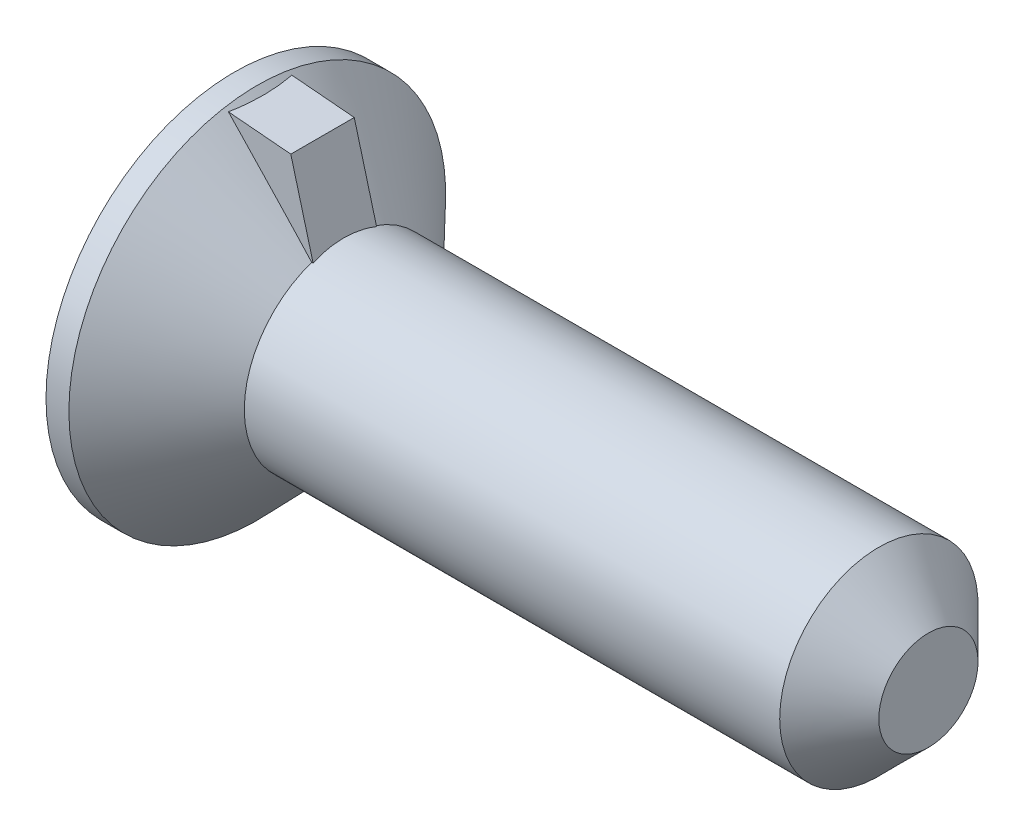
SolidWorks part; units mm, degrees
ref_plane "Front Plane" through (0, 0, 0) normal (0, 0, 1) x (1, 0, 0)
ref_plane "Top Plane" through (0, 0, 0) normal (0, 1, 0) x (1, 0, 0)
ref_plane "Right Plane" through (0, 0, 0) normal (1, 0, 0) x (0, 0, -1)
other "Configuration Table"
sketch "BodySke" plane through (0, 0, 0) normal (0, 0, 1) x (1, 0, 0)
  line L0 (0, 0) -> (44.1549, 0) construction
  line L1 (0, 0) -> (0, 9.5)
  line L2 (0, 9.5) -> (1.1544, 9.5)
  line L3 (1.1544, 9.5) -> (5.5, 5)
  line L4 (5.5, 5) -> (32.5, 5)
  line L5 (32.5, 5) -> (35, 2.5)
  line L6 (35, 2.5) -> (35, 0)
  line L7 (35, 0) -> (0, 0)
  line L8 (0, -9.5) -> (1.1544, -9.5) construction
  line L9 (1.1544, -9.5) -> (5.5, -5) construction
  line L10 (5.5, 5) -> (5.5, 0) construction
  line L11 (33.5, 0) -> (33.5, 5) construction
  line L12 (5.5, 5) -> (5.5, 13.4) construction
  line L13 (1.4441, 9.2) -> (4.445, 8.9375) construction
  line L14 (4.445, 8.9375) -> (5.5, 5) construction
  line L15 (1.4441, 9.2) -> (5.5, 9.2) construction
  point P19 (0, 4.172)
revolve "BaseBody" add sketch "BodySke" angle 360 about L0
sketch "NibSke" plane through (0, 0, 0) normal (0, 0, 1) x (1, 0, 0)
  line L0 (4.445, 8.9375) -> (6.8397, 0)
  line L1 (35, 0) -> (0, 0) construction
  line L2 (6.8397, 0) -> (1.1544, 0)
  line L5 (1.1544, 9.2253) -> (4.445, 8.9375)
  line L6 (4.445, 8.9375) -> (5.5, 5) construction
  line L7 (1.4441, 9.2) -> (4.445, 8.9375) construction
  line L8 (1.1544, 9.2253) -> (1.1544, 0)
  line L9 (1.1544, 9.5) -> (1.1544, -9.5) construction
extrude "Nib" add sketch "NibSke" along normal mid plane 3.2
sketch "ThdSchSke" plane through (0, 0, 0) normal (0, 0, 1) x (1, 0, 0)
  line L0 (0, 0) -> (35.8559, 0) construction
  line L1 (0, 9.5) -> (0, -9.5) construction
  line L2 (31, 5.9561) -> (31, 5)
  line L3 (31, 5.9561) -> (31.9561, 5.9561)
  line L4 (31.9561, 5.9561) -> (31.9561, 5)
  line L5 (31.9561, 5) -> (31.478, 4.172)
  line L6 (31.478, 4.172) -> (31, 5)
revolve "ThreadSchematic" [suppressed] cut sketch "ThdSchSke" angle 360 about L0
pattern_linear "ThdSchPat" [suppressed]
equation "\"Thread_minor@ThreadCosmetic\" = \"Thread_minor@BodySke\""
equation "\"D1@ThdSchSke\" = \"Advance@BodySke\""
equation "\"Advance@ThdSchPat\" = \"Advance@BodySke\""
equation "\"Teeth_Num@ThdSchPat\" =  int( (  \"Thread_length@BodySke\" - \"Depth_Chamfer@BodySke\" )  / \"Advance@BodySke\" )  - 1"
